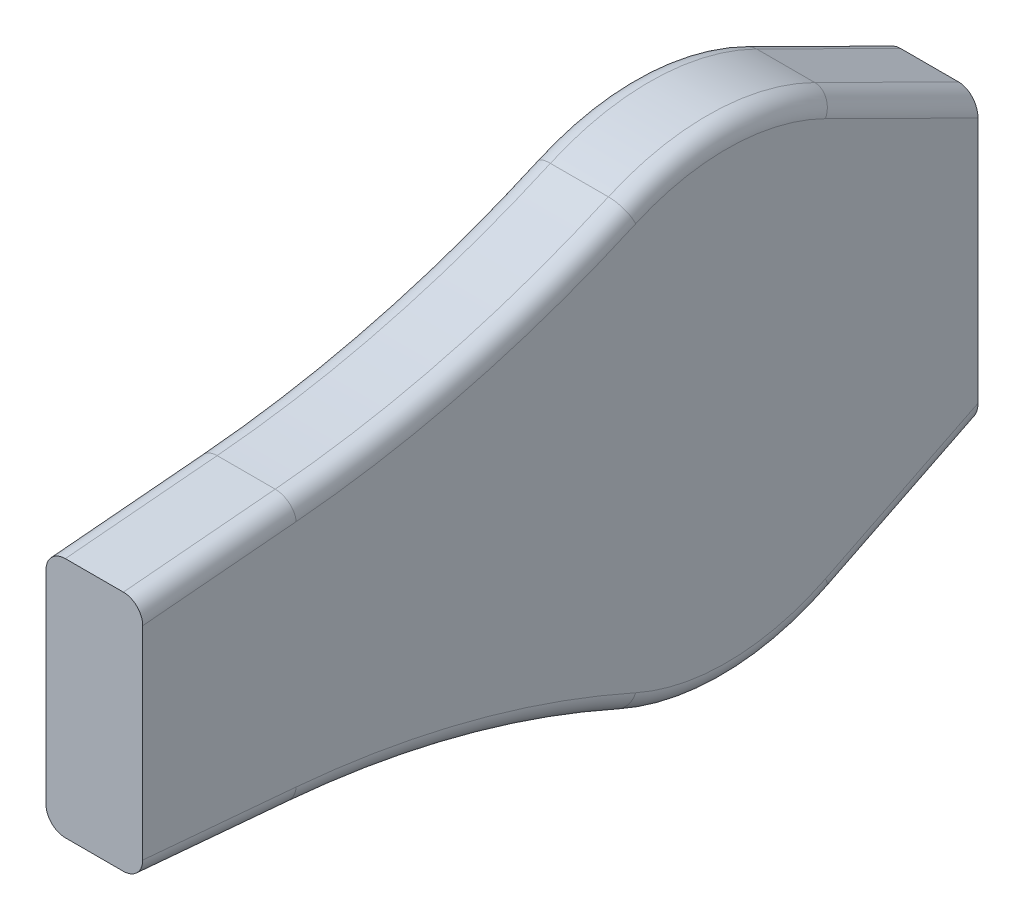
SolidWorks part; units mm, degrees
ref_plane "Front Plane" through (0, 0, 0) normal (0, 0, 1) x (1, 0, 0)
ref_plane "Top Plane" through (0, 0, 0) normal (0, 1, 0) x (1, 0, 0)
ref_plane "Right Plane" through (0, 0, 0) normal (1, 0, 0) x (0, 0, -1)
sketch "Sketch1" plane through (0, 0, 0) normal (1, 0, 0) x (0, 0, -1)
  line L0 (0, 0) -> (-30.18, 0) construction
  line L1 (2.75, 0) -> (-2.75, 0) construction
  line L2 (-30.18, 6.25) -> (-30.18, -6.25)
  line L3 (5.5605, 11.1951) -> (13, 7.5)
  line L4 (13, 7.5) -> (13, -7.5)
  line L5 (0, 2.75) -> (0, -2.75) construction
  line L6 (-30.18, 6.25) -> (-22.3313, 6.9367)
  line L7 (5.5605, -11.1951) -> (13, -7.5)
  line L8 (-30.18, -6.25) -> (-22.3313, -6.9367)
  arc A0 (-5.1066, -11.4093) -> (5.5605, -11.1951) centre (0, 0) ccw
  arc A1 (-5.1066, 11.4093) -> (-22.3313, 6.9367) centre (-27.0026, 60.3298) cw
  arc A2 (-5.1066, -11.4093) -> (-22.3313, -6.9367) centre (-27.0026, -60.3298) ccw
  arc A3 (5.5605, 11.1951) -> (-5.1066, 11.4093) centre (0, 0) ccw
  point P23 (13, 0)
  dimension "D1" = 25
  dimension "D7" = 53.5971
  dimension "D2" = 12.5
  dimension "D3" = 13
  dimension "D4" = 43.18
  dimension "D5" = 15
  dimension "D6" = 95
extrude "Boss-Extrude1" add sketch "Sketch1" against normal blind 4 and the other way blind 1
fillet "Fillet1" radius 1 16 edges at (-4, -9.3476, -9.2803) (-4, -12.4975, -0.2509) (-4, -8.4531, 13.532) (1, -9.3476, -9.2803) (1, -12.4975, -0.2509) (1, -8.4531, 13.532) (-4, 9.3476, -9.2803) (-4, 12.4975, -0.2509) (-4, 8.4531, 13.532) (1, 9.3476, -9.2803) (1, 12.4975, -0.2509) (1, 8.4531, 13.532) (-4, -6.5933, 26.2556) (1, -6.5933, 26.2556) (-4, 6.5933, 26.2556) (1, 6.5933, 26.2556)
